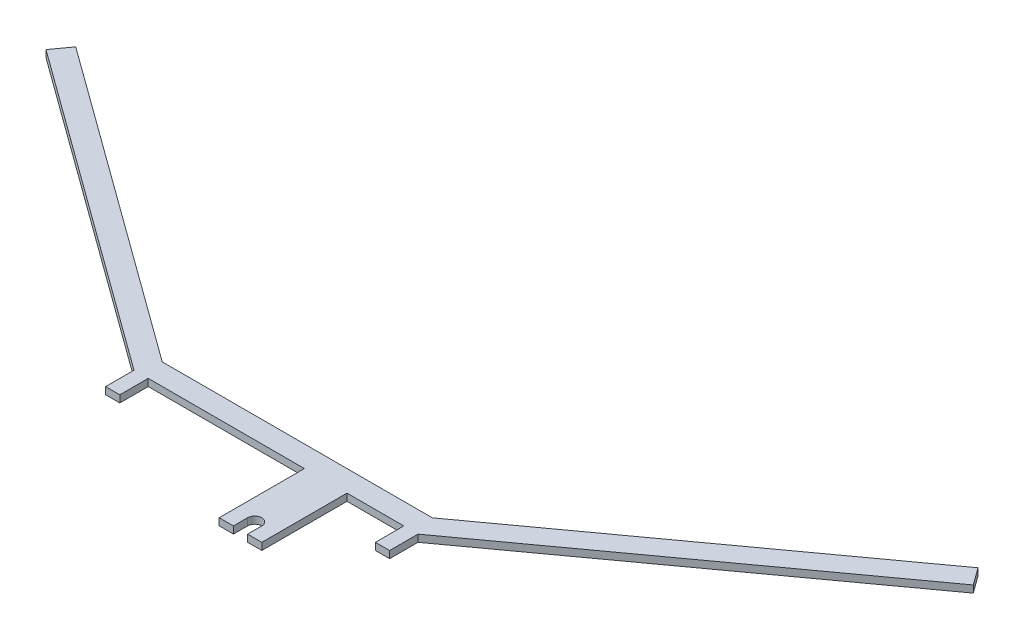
SolidWorks part; units mm, degrees
ref_plane "前视基准面" through (0, 0, 0) normal (0, 0, 1) x (1, 0, 0)
ref_plane "上视基准面" through (0, 0, 0) normal (0, 1, 0) x (1, 0, 0)
ref_plane "右视基准面" through (0, 0, 0) normal (1, 0, 0) x (0, 0, -1)
sketch "草图1" plane through (0, 0, 0) normal (0, 1, 0) x (1, 0, 0)
  line L0 (0, 0) -> (0, -51.4782) construction
  line L1 (-31.7734, -28.8317) -> (-9.5127, -45)
  line L2 (-9.5127, -45) -> (9.5127, -45)
  line L3 (-31.7734, -28.8317) -> (-32.6549, -30.0454)
  line L4 (-32.6549, -30.0454) -> (-10, -46.5)
  line L5 (-10, -46.5) -> (10, -46.5)
  line L6 (31.7734, -28.8317) -> (32.6549, -30.0454)
  line L7 (31.7734, -28.8317) -> (9.5127, -45)
  line L8 (32.6549, -30.0454) -> (10, -46.5)
  circle A0 centre (0, 0) radius 42 construction
  point P8 (0, -42)
  point P14 (0, -46.5)
  point P15 (0, -45)
  dimension "D1" = 84
  dimension "D2" = 20
  dimension "D3" = 3
  dimension "D4" = 1.5
  dimension "D5" = 1.5
  dimension "D6" = 28
extrude "凸台-拉伸1" add sketch "草图1" along normal mid plane 0.5
sketch "草图2" plane through (0, 0.25, 0) normal (0, 1, 0) x (1, 0, 0)
  line L0 (0, -45) -> (0, -49.7255) construction
  line L1 (9.5127, -45) -> (-9.5127, -45) construction
  line L2 (-10, -46.5) -> (10, -46.5) construction
  line L3 (-10, -46.5) -> (-9, -46.5)
  line L4 (-10, -46.5) -> (-10, -48.5)
  line L5 (-10, -48.5) -> (-9, -48.5)
  line L6 (-9, -46.5) -> (-9, -48.5)
  line L7 (10, -48.5) -> (9, -48.5)
  line L8 (9, -46.5) -> (9, -48.5)
  line L9 (10, -46.5) -> (9, -46.5)
  line L10 (10, -46.5) -> (10, -48.5)
  point P11 (-9.5, -48.5)
  dimension "D1" = 1
  dimension "D2" = 2
extrude "凸台-拉伸2" add sketch "草图2" against normal up to surface (0.5 mm away)
sketch "草图5" plane through (0, -0.25, 0) normal (0, -1, 0) x (1, 0, 0)
  line L1 (9, 46.5) -> (13.5371, 46.5)
  line L2 (9, 46.5) -> (9, 50.8222)
  line L3 (9, 50.8222) -> (13.5371, 50.8222)
  line L4 (13.5371, 46.5) -> (13.5371, 50.8222)
extrude "切除-拉伸1" cut sketch "草图5" against normal through all
sketch "草图6" plane through (0, -0.25, 0) normal (0, -1, 0) x (1, 0, 0)
  line L0 (-9, 46.5) -> (10, 46.5) construction
  line L1 (5, 46.5) -> (2, 46.5)
  line L2 (5, 46.5) -> (5, 52.5)
  line L3 (5, 52.5) -> (2, 52.5)
  line L4 (2, 46.5) -> (2, 52.5)
  line L5 (10, 46.5) -> (10, 49.9674) construction
  dimension "D1" = 6
  dimension "D2" = 3
  dimension "D3" = 5
extrude "凸台-拉伸3" add sketch "草图6" against normal up to surface (0.5 mm away)
sketch "草图7" plane through (0, -0.25, 0) normal (0, -1, 0) x (1, 0, 0)
  line L0 (3.5, 52.5) -> (3.5, 51.5) construction
  line L1 (5, 52.5) -> (2, 52.5) construction
  line L2 (3, 51.5) -> (3, 55.2784)
  line L3 (3, 55.2784) -> (4, 55.2784)
  line L4 (4, 55.2784) -> (4, 51.5)
  arc A0 (3, 51.5) -> (4, 51.5) centre (3.5, 51.5) ccw
  dimension "D1" = 1
  dimension "D2" = 1
extrude "切除-拉伸2" cut sketch "草图7" against normal through all
sketch "草图8" plane through (0, -0.25, 0) normal (0, -1, 0) x (1, 0, 0)
  line L0 (10, 46.5) -> (10, 48.5)
  line L1 (10, 48.5) -> (9, 48.5)
  line L2 (9, 48.5) -> (9, 46.5)
  line L3 (5, 46.5) -> (10, 46.5) construction
  line L4 (9, 46.5) -> (10, 46.5)
  dimension "D1" = 2
  dimension "D2" = 1
extrude "凸台-拉伸4" add sketch "草图8" against normal up to surface (0.5 mm away)
